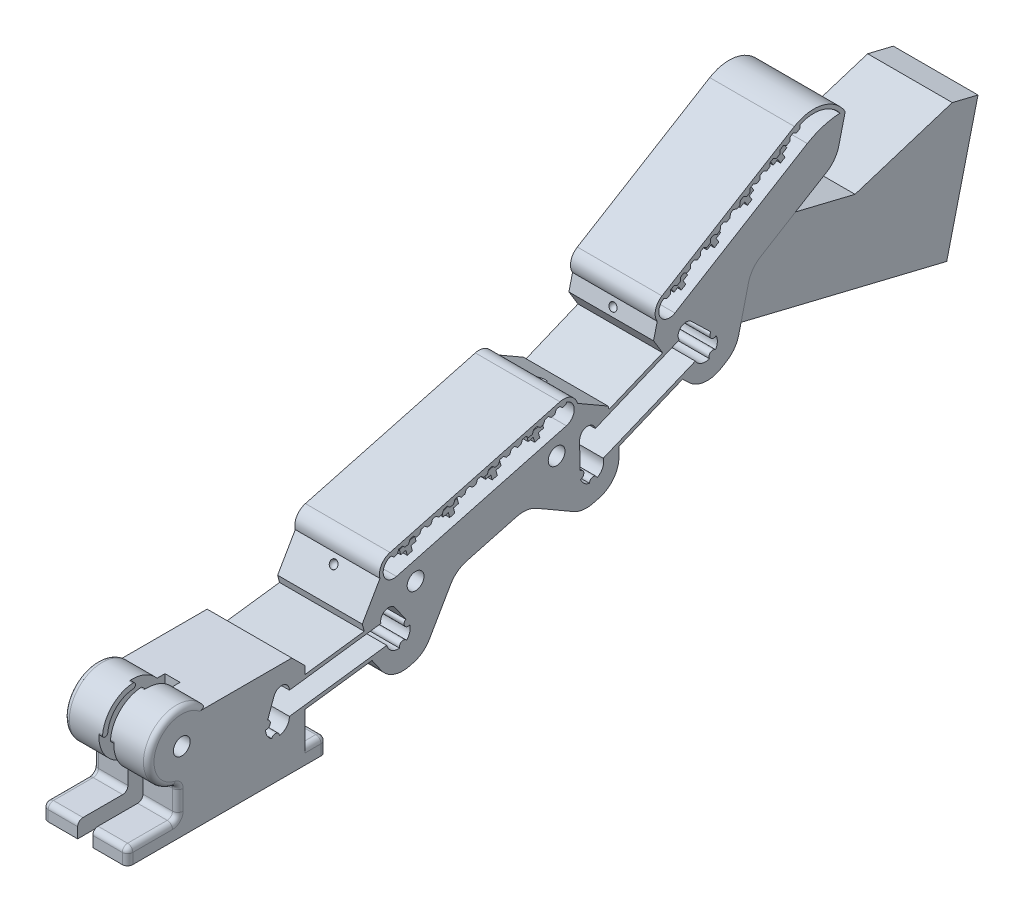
SolidWorks part; units mm, degrees
other "<finger>-<Pulley Cover Fillet>"
ref_plane "Front Plane" through (0, 0, 0) normal (0, 0, 1) x (1, 0, 0)
ref_plane "Top Plane" through (0, 0, 0) normal (0, 1, 0) x (1, 0, 0)
ref_plane "Right Plane" through (0, 0, 0) normal (1, 0, 0) x (0, 0, -1)
inserted part "finger"
sketch "Sketch1" plane through (5, 0, 0) normal (-1, 0, 0) x (0, 0, 1)
  line L0 (-108.3813, 39.7388) -> (-90.2828, 28.7271) construction
  line L1 (-90.0421, 24.9873) -> (-97.1743, 19.2768) construction
  line L2 (-99.2812, 34.202) -> (-90.2828, 28.7271)
  line L3 (-90.0421, 24.9873) -> (-97.1743, 19.2768)
  line L4 (-97.1743, 19.2768) -> (-110.092, 16.132)
  line L5 (-99.2812, 34.202) -> (-118.7136, 29.4712)
  line L6 (-80.6304, 24.53) -> (-81.3223, 27.3723) construction
  line L9 (-118.7136, 29.4712) -> (-137.0946, 35.2884)
  line L10 (-137.0946, 35.2884) -> (-141.9527, 34.1057)
  line L11 (-141.9527, 34.1057) -> (-136.0392, 9.8152)
  line L12 (-136.0392, 9.8152) -> (-110.092, 16.132)
  arc A0 (-90.0421, 24.9873) -> (-90.2828, 28.7271) centre (-91.4718, 26.7729) ccw construction
  arc A1 (-90.0421, 24.9873) -> (-90.2828, 28.7271) centre (-91.4718, 26.7729) ccw
  dimension "D1" = 25
  dimension "D2" = 20
  dimension "D3" = 5
  dimension "D4" = 40
  dimension "D5" = 15
extrude "Main Body" add sketch "Sketch1" along normal up to surface (10 mm away) separate body
sketch "Sketch2" plane through (-5, 0, 0) normal (-1, 0, 0) x (0, 0, 1)
  line L1 (-97.1743, 19.2768) -> (-98.5897, 25.0908) construction
  line L2 (-100.8489, 28.1796) -> (-113.3727, 35.7994) construction
  line L3 (-97.1743, 19.2768) -> (-98.5897, 25.0908)
  line L4 (-97.1743, 19.2768) -> (-136.0392, 9.8152) construction
  line L5 (-136.0392, 9.8152) -> (-141.9527, 34.1057) construction
  line L6 (-141.9527, 34.1057) -> (-137.0946, 35.2884) construction
  line L7 (-137.0946, 35.2884) -> (-118.7136, 29.4712) construction
  line L9 (-97.1743, 19.2768) -> (-136.0392, 9.8152)
  line L10 (-136.0392, 9.8152) -> (-141.9527, 34.1057)
  line L11 (-141.9527, 34.1057) -> (-137.0946, 35.2884)
  line L12 (-137.0946, 35.2884) -> (-118.7136, 29.4712)
  line L13 (-100.8489, 28.1796) -> (-107.4705, 32.2083)
  line L14 (-107.4705, 32.2083) -> (-118.7136, 29.4712)
  line L15 (-118.7136, 29.4712) -> (-99.2812, 34.202) construction
  arc A1 (-98.5897, 25.0908) -> (-100.8489, 28.1796) centre (-103.4478, 23.9081) ccw construction
  arc A3 (-98.5897, 25.0908) -> (-100.8489, 28.1796) centre (-103.4478, 23.9081) ccw
extrude "Side Body" add sketch "Sketch2" along normal up to surface and the other way up to surface separate body
combine bodies "Combine1" operation type add bodies to combine 102 103
sketch "Sketch3" plane through (0, 40.5317, -9.8674) normal (0, -0.9716, 0.2365) x (1, 0, 0)
  line L0 (-8, -89.8569) -> (8, -89.8569) construction
  line L1 (0, -89.8569) -> (0, -129.8569) construction
  line L2 (-8, -129.8569) -> (8, -129.8569) construction
  line L3 (-5, -81.5763) -> (-5, -89.8569) construction
  line L4 (-2, -89.8569) -> (2, -89.8569)
  line L5 (-2, -89.8569) -> (-2, -74.2271)
  line L6 (-2, -74.2271) -> (2, -74.2271)
  line L7 (2, -89.8569) -> (2, -74.2271)
  dimension "D1" = 3
extrude "Cut-Extrude1" cut sketch "Sketch3" against normal through all
ref_point "Ref Center"
equation "\"D1@Sketch3\"=\"width keep@values@params.sldprt\""
